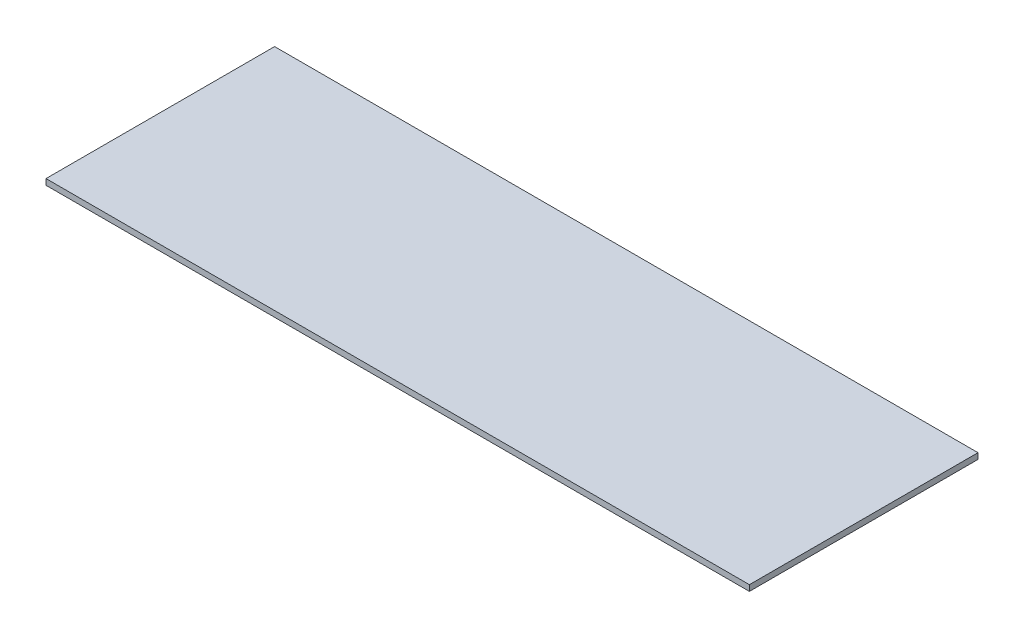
SolidWorks part; units mm, degrees
ref_plane "Front Plane" through (0, 0, 0) normal (0, 0, 1) x (1, 0, 0)
ref_plane "Top Plane" through (0, 0, 0) normal (0, 1, 0) x (1, 0, 0)
ref_plane "Right Plane" through (0, 0, 0) normal (1, 0, 0) x (0, 0, -1)
sketch "Sketch1" plane through (0, 0, 0) normal (0, 1, 0) x (1, 0, 0)
  line L1 (-381, -123.825) -> (381, -123.825)
  line L2 (-381, -123.825) -> (-381, 123.825)
  line L3 (-381, 123.825) -> (381, 123.825)
  line L4 (381, -123.825) -> (381, 123.825)
  line L5 (-381, -123.825) -> (381, 123.825) construction
  line L6 (-381, 123.825) -> (381, -123.825) construction
  point P0 (0, 0)
  dimension "D1" = 247.65
  dimension "D2" = 762
extrude "Boss-Extrude1" add sketch "Sketch1" along normal blind 6.35
